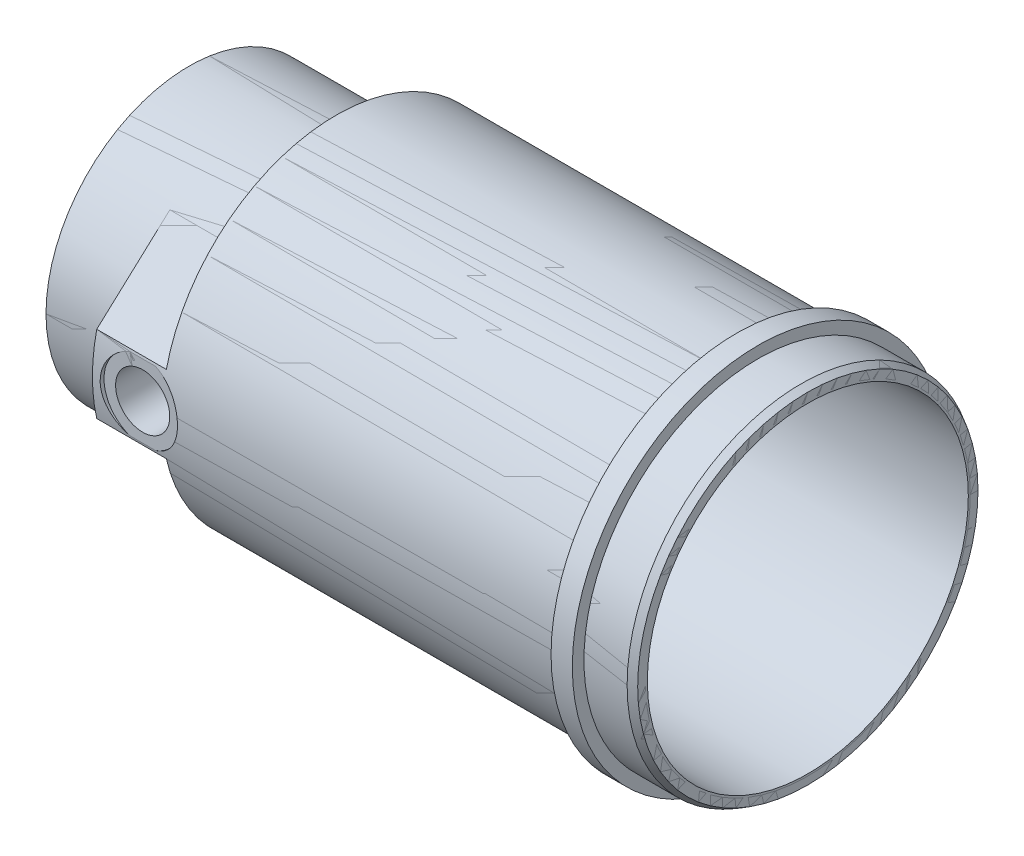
SolidWorks part; units mm, degrees
ref_plane "Plan de face" through (0, 0, 0) normal (0, 0, 1) x (1, 0, 0)
ref_plane "Plan de dessus" through (0, 0, 0) normal (0, 1, 0) x (1, 0, 0)
ref_plane "Plan de droite" through (0, 0, 0) normal (1, 0, 0) x (0, 0, -1)
imported_body "Importée1"
sketch "Esquisse1" plane through (0, 0, 0) normal (1, 0, 0) x (0, 0, -1)
  circle A0 centre (0, 0) radius 21
  dimension "D1" = 42
extrude "ALESAGE" cut sketch "Esquisse1" against normal up to surface (58 mm away)
